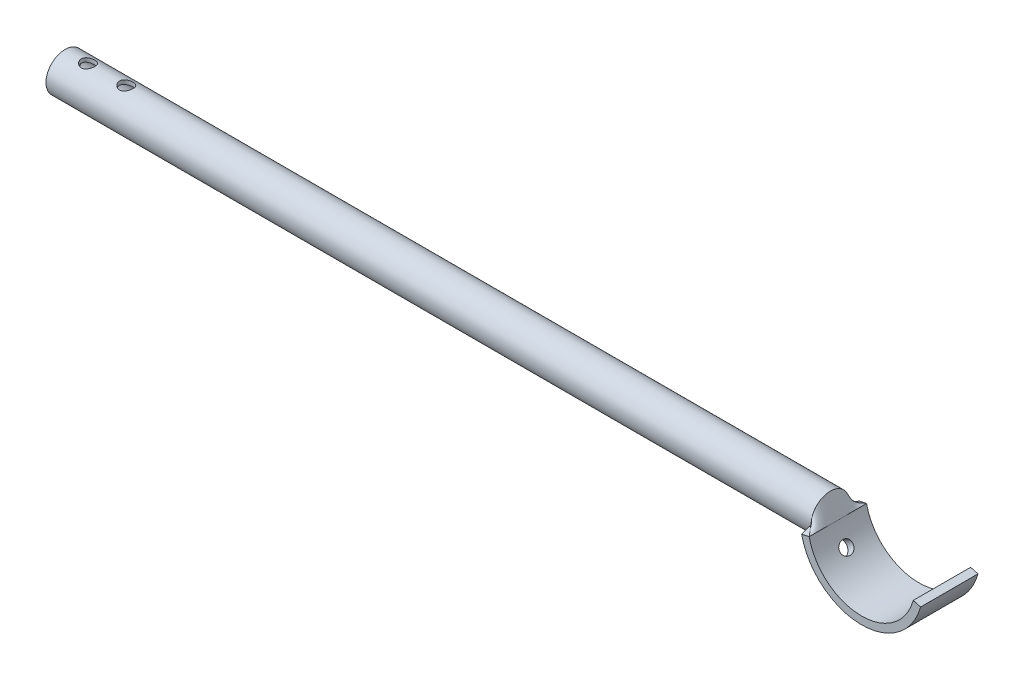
SolidWorks part; units mm, degrees
ref_plane "Front Plane" through (0, 0, 0) normal (0, 0, 1) x (1, 0, 0)
ref_plane "Top Plane" through (0, 0, 0) normal (0, 1, 0) x (1, 0, 0)
ref_plane "Right Plane" through (0, 0, 0) normal (1, 0, 0) x (0, 0, -1)
sketch "Sketch1" plane through (0, 0, 0) normal (1, 0, 0) x (0, 0, -1)
  circle A0 centre (0, 0) radius 4
  circle A1 centre (0, 0) radius 5
  dimension "D1" = 8
  dimension "D2" = 10
extrude "Extrude1" add sketch "Sketch1" along normal blind 200
sketch "Sketch2" plane through (0, 0, 0) normal (0, 1, 0) x (1, 0, 0)
  line L0 (0, 0) -> (16, 0) construction
  line L1 (0, 5) -> (0, -5) construction
  circle A0 centre (6, 0) radius 1.75
  circle A1 centre (16, 0) radius 1.75
  dimension "D1" = 6
  dimension "D2" = 10
  dimension "D3" = 3.5
extrude "Extrude2" cut sketch "Sketch2" against normal mid plane 200
sketch "Sketch5" plane through (0, 0, 0) normal (0, 1, 0) x (1, 0, 0)
  line L0 (200, 0) -> (194, 0) construction
  line L1 (200, -5) -> (200, 5) construction
  line L2 (0, 5) -> (0, -5) construction
  circle A0 centre (194, 0) radius 2.75
  dimension "D1" = 5.5
  dimension "D2" = 194
extrude "Extrude4" cut sketch "Sketch5" against normal blind 15
ref_plane "Plane1" through (0, -1, 0) normal (0, 1, 0) x (-1, 0, 0)
sketch "Sketch7" plane through (0, -1, 0) normal (0, 1, 0) x (-1, 0, 0)
  line L0 (-200, 0) -> (-240, 0) construction
  line L1 (-200, 5) -> (-200, -5) construction
  line L2 (-200, 7.5) -> (-240, 7.5)
  line L3 (-200, -7.5) -> (-240, -7.5)
  line L4 (-240, 7.5) -> (-240, -7.5)
  line L5 (-200, 7.5) -> (-200, -7.5)
  circle A0 centre (-230, 0) radius 1.75
  circle A1 centre (-206, 0) radius 1.75
  dimension "D2" = 3.5
  dimension "D4" = 24
  dimension "D1" = 40
  dimension "D3" = 10
  dimension "D5" = 7.5
  dimension "D6" = 7.5
sheet metal parameters "Sheet-Metal1" thickness 2 parameters "D1"=0.7366
base flange "Base-Flange1" sketch "Sketch7" thickness 2 reverse thickness direction yes parameters "D1"=0.7366
sketch "Sketch9" plane through (0, 1, 0) normal (0, 1, 0) x (1, 0, 0)
  line L0 (220, -7.5) -> (220, 7.5)
  line L1 (200, -7.5) -> (240, -7.5) construction
  line L2 (240, 7.5) -> (200, 7.5) construction
sketched bend "Sketched Bend2" parameters "D1"=14
bend "SketchBend1" bend radius 14 bend angle 152.5 parameters "D5"=1
move or copy body "Body-Move/Copy1" bodies to move or copy 107 copy no rotation origin (200.0378, -1, 0) rotation axis (0, 0, -1) rotation angle 78
surface "Surface-Loft1"
sketch "Sketch10" plane through (0, 0, 0) normal (0, 0, 1) x (1, 0, 0)
  line L0 (215.6882, 2.3266) -> (215.6882, -26.6551) construction
  line L1 (215.6882, 2.3266) -> (228.2576, -14.3536) construction
  line L2 (215.6882, 2.3266) -> (199.5766, -8.9548) construction
  dimension "D1" = 55
  dimension "D2" = 37
flat pattern "Flat-Pattern1"
sketch "Bend-Lines1" plane through (0, 0, 0) normal (0, 1, 0) x (-1, 0, 0)
bend of the flat pattern "Flatten-<SketchBend1>1"
